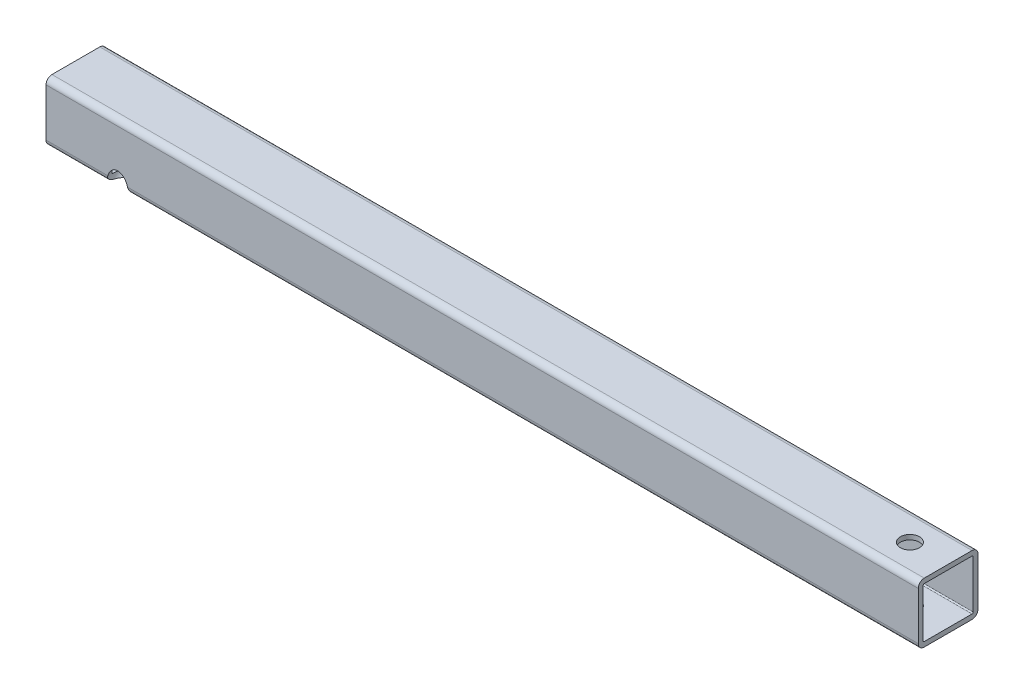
SolidWorks part; units mm, degrees
ref_plane "Plan de face" through (0, 0, 0) normal (0, 0, 1) x (1, 0, 0)
ref_plane "Plan de dessus" through (0, 0, 0) normal (0, 1, 0) x (1, 0, 0)
ref_plane "Plan de droite" through (0, 0, 0) normal (1, 0, 0) x (0, 0, -1)
sketch "Esquisse1" plane through (0, 0, 0) normal (1, 0, 0) x (0, 0, -1)
  line L0 (-10, 10.5) -> (10, 10.5)
  line L1 (-10, 12.5) -> (10, 12.5)
  line L2 (-12.5, 10) -> (-12.5, -10)
  line L3 (-10, -12.5) -> (10, -12.5)
  line L4 (12.5, 10) -> (12.5, -10)
  line L5 (-12.5, 12.5) -> (12.5, -12.5) construction
  line L6 (-12.5, -12.5) -> (12.5, 12.5) construction
  line L7 (10.5, 10) -> (10.5, -10)
  line L8 (-10, -10.5) -> (10, -10.5)
  line L9 (-10.5, 10) -> (-10.5, -10)
  arc A0 (-12.5, -10) -> (-10, -12.5) centre (-10, -10) ccw
  arc A1 (10, -12.5) -> (12.5, -10) centre (10, -10) ccw
  arc A2 (10, 12.5) -> (12.5, 10) centre (10, 10) cw
  arc A3 (-10, 12.5) -> (-12.5, 10) centre (-10, 10) ccw
  arc A4 (10, 10.5) -> (10.5, 10) centre (10, 10) cw
  arc A5 (10, -10.5) -> (10.5, -10) centre (10, -10) ccw
  arc A6 (-10.5, -10) -> (-10, -10.5) centre (-10, -10) ccw
  arc A7 (-10, 10.5) -> (-10.5, 10) centre (-10, 10) ccw
  point P0 (0, 0)
  dimension "D2" = 2.5
  dimension "D1" = 25
  dimension "D3" = 2
extrude "Boss.-Extru.1" add sketch "Esquisse1" along normal blind 365
sketch "Esquisse2" plane through (0, 12.5, 0) normal (0, -1, 0) x (1, 0, 0)
  line L2 (365, 10) -> (365, -10) construction
  circle A0 centre (349, 0) radius 4
  dimension "D1" = 8
  dimension "D2" = 16
extrude "Enlèv. mat.-Extru.1" cut sketch "Esquisse2" along normal through all
ref_plane "Plan1" through (0, -11.7678, 11.7678) normal (0, -0.7071, 0.7071) x (-1, 0, 0)
sketch "Esquisse3" plane through (0, -11.7678, 11.7678) normal (0, -0.7071, 0.7071) x (-1, 0, 0)
  line L0 (0, -15.9099) -> (0, -1.7678) construction
  circle A0 centre (-30, 0) radius 4.5
  dimension "D1" = 9
  dimension "D2" = 30
extrude "Enlèv. mat.-Extru.2" cut sketch "Esquisse3" against normal up to next
